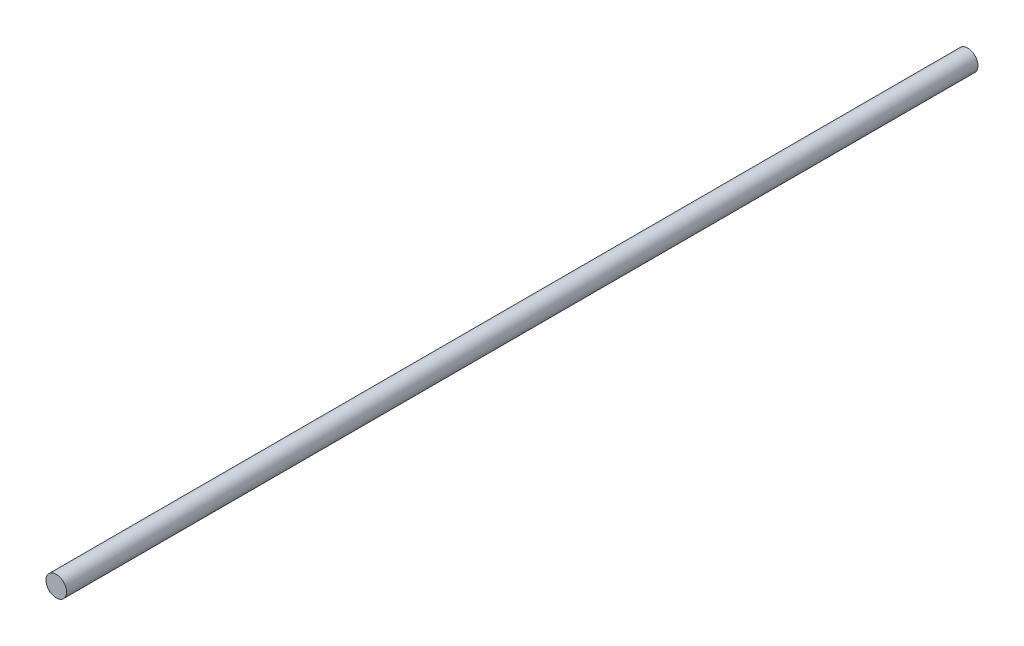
SolidWorks part; units mm, degrees
ref_plane "Plan_Face" through (0, 0, 0) normal (0, 0, 1) x (1, 0, 0)
ref_plane "Plan_Dessus" through (0, 0, 0) normal (0, 1, 0) x (1, 0, 0)
ref_plane "Plan_Droite" through (0, 0, 0) normal (1, 0, 0) x (0, 0, -1)
sketch "Esquisse1" plane through (0, 0, 0) normal (0, 0, 1) x (1, 0, 0)
  circle A0 centre (0, 0) radius 4
  dimension "D1" = 8
extrude "Extrusion1" add sketch "Esquisse1" along normal blind 355
ref_point "Point1"
